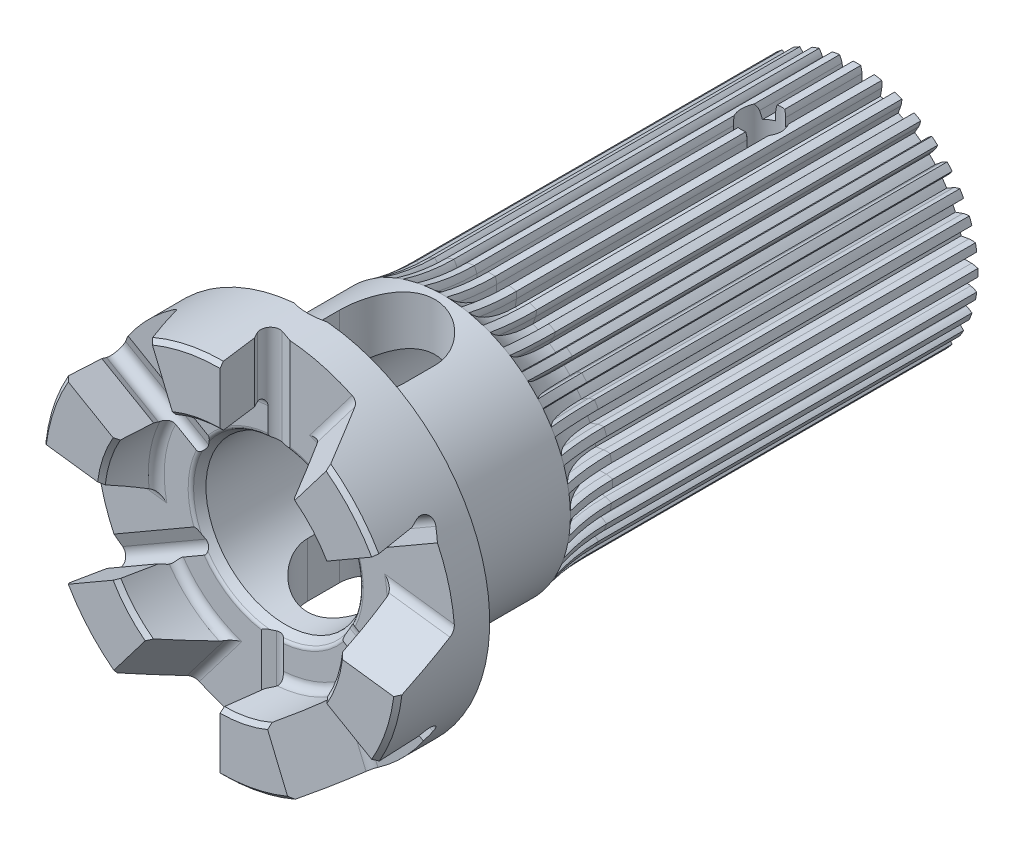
SolidWorks part; units mm, degrees
other "Исправление1"
sketch "Эскиз13" plane through (-22.5, 22.5, -80) normal (-0.4507, 0.8926, -0.0137) x (0.0569, 0.0134, -0.9983)
other "Исправление2"
sketch "Эскиз15" plane through (-22.5, -22.5, -80) normal (-0.1822, -0.9519, -0.2463) x (0.0762, -0.2634, 0.9617)
ref_plane "Спереди" through (0, 0, 0) normal (0, 0, 1) x (1, 0, 0)
ref_plane "Сверху" through (0, 0, 0) normal (0, 1, 0) x (1, 0, 0)
ref_plane "Справа" through (0, 0, 0) normal (1, 0, 0) x (0, 0, -1)
sketch "Эскиз1" plane through (0, 0, 0) normal (1, 0, 0) x (0, 0, -1)
  line L0 (0, 22.5) -> (0, 0) construction
  line L1 (0, 0) -> (80, 0) construction
  line L2 (0.5, 22.5) -> (11.3738, 22.5)
  line L6 (7, 15) -> (0.5, 15)
  line L7 (0, 15.5) -> (0, 22)
  line L8 (7, 15) -> (7, 11)
  line L9 (7.25, 10.567) -> (8.2321, 10)
  line L10 (8.2321, 10) -> (78.5, 10)
  line L13 (14, 16) -> (11.3738, 22.5)
  line L18 (0, 22) -> (0.5, 22.5)
  line L19 (0.5, 15) -> (0, 15.5)
  line L22 (14, 16) -> (28, 16)
  line L23 (34.1188, 13.4) -> (80, 13.4)
  line L24 (80, 13.4) -> (80, 10.866)
  line L25 (80, 10.866) -> (78.5, 10)
  arc A0 (7.25, 10.567) -> (7, 11) centre (7.5, 11) cw
  arc A3 (34.1188, 13.4) -> (28, 16) centre (34.1188, 21.9) cw
  point P3 (0, 22.5)
  point P10 (0, 15)
  dimension "D6" = 0.5
  dimension "D11" = 32
  dimension "D12" = 1.5
  dimension "D8" = 8.5
  dimension "D1" = 30
  dimension "D2" = 45
  dimension "D3" = 20
  dimension "D4" = 7
  dimension "D5" = 30
  dimension "D7" = 22
  dimension "D10" = 26.8
  dimension "D13" = 30
  dimension "D14" = 22
  dimension "D15" = 80
  dimension "D17" = 0.5
  dimension "D18" = 45
  dimension "D19" = 0.5
  dimension "D20" = 45
  dimension "D22" = 52
  dimension "D23" = 66
revolve "Повернуть1" add sketch "Эскиз1" angle 360 about L1
sketch "Эскиз2" plane through (0, 0, 0) normal (0, 0, 1) x (1, 0, 0)
  line L0 (0, 0) -> (0, 22.5) construction
  line L1 (-19.4856, -11.25) -> (0, 0) construction
  line L3 (0, 0) -> (0, -22.5) construction
  circle A0 centre (0, 0) radius 22.5 construction
  dimension "D1" = 60
ref_plane "Плоскость1" through (0, 0, 0) normal (0.5, -0.866, 0) x (0.866, 0.5, 0)
sketch "Эскиз4" plane through (0, 0, 0) normal (0, 0, 1) x (1, 0, 0)
  line L0 (0, -22.5) -> (0, 22.5) construction
  line L1 (0, 0) -> (-19.4856, 11.25) construction
  line L3 (0, 0) -> (-9.412, 22.5)
  circle A0 centre (0, 0) radius 22.5 construction
  point P4 (0, 0)
  dimension "D1" = 120
  dimension "D2" = 37.3
sketch "Эскиз3" plane through (0, 0, 0) normal (0.5, -0.866, 0) x (0.866, 0.5, 0)
  line L0 (0, 0) -> (-4.0415, -7)
  line L3 (-4.0415, -7) -> (-7, -7)
  line L5 (0, 0) -> (11.25, 0) construction
  line L7 (0, 0) -> (-11.25, 0) construction
  line L12 (-7, -7) -> (-7, 0)
  line L13 (-15, 0) -> (15, 0) construction
  line L14 (0, 0) -> (-7, 0)
  dimension "D1" = 60
  dimension "D2" = 7
  dimension "D3" = 7
sweep "Вырез-По траектории1" cut profiles "Эскиз3" path "Эскиз4"
sketch "Эскиз5" plane through (0, 0, 0) normal (0, 0, 1) x (1, 0, 0)
  line L0 (0, -18.5017) -> (0, 18.5017) construction
  line L1 (-12.9904, 7.5) -> (-19.4856, 11.25)
  line L2 (-5.9815, 14.2993) -> (-8.4899, 20.2958) construction
  line L5 (-12.9904, 7.5) -> (0, 0) construction
  line L6 (-11.5365, 9.5869) -> (-14.6645, 17.0646) construction
  line L7 (-11.5365, 9.5869) -> (-14.6645, 17.0646)
  circle A0 centre (0, 0) radius 15 construction
  arc A1 (-14.6645, 17.0646) -> (-19.4856, 11.25) centre (0, 0) ccw
  arc A3 (-11.5365, 9.5869) -> (-12.9904, 7.5) centre (0, 0) ccw
  circle A5 centre (0, 0) radius 22.5 construction
  point P4 (0, 0)
  dimension "D1" = 37.3
extrude "Вырез-Вытянуть1" cut sketch "Эскиз5" against normal up to surface (7 mm away)
pattern_circular "Круговой массив1" count 6 over 360 about axis through (0, 0, 0) along (0, 0, 1) of "Вырез-По траектории1", "Вырез-Вытянуть1"
fillet "Скругление1" radius 1.2 12 edges at (-7.8991, -16.9842, -7) (-7.2728, -13.1189, -3.7798) (10.7592, -15.3329, -7) (7.7249, -12.8579, -3.7798) (18.6583, 1.6513, -7) (14.9977, 0.261, -3.7798) (7.8991, 16.9842, -7) (7.2728, 13.1189, -3.7798) (-10.7592, 15.3329, -7) (-7.7249, 12.8579, -3.7798) (-18.6583, -1.6513, -7) (-14.9977, -0.261, -3.7798)
sketch "Эскиз6" plane through (0, 0, 0) normal (0, 1, 0) x (1, 0, 0)
  line L0 (0, 0) -> (0.654, 4.9679)
  line L2 (0.654, 4.9679) -> (1.0591, 5.7459)
  line L3 (-1.7759, 7) -> (-0.3662, 7.4445)
  line L4 (-11, 7) -> (11, 7) construction
  line L5 (0, 0) -> (0, 7)
  line L6 (-0.0054, 7.5) -> (-1.7759, 7.5) construction
  line L7 (0, 0) -> (5.9815, 0) construction
  line L8 (0, 7) -> (-1.7759, 7)
  arc A0 (-0.3662, 7.4445) -> (1.0591, 5.7459) centre (-0.0054, 6.3) cw
  dimension "D6" = 1.2
  dimension "D1" = 7.5
  dimension "D2" = 20
  dimension "D3" = 0.3
  dimension "D4" = 45
  dimension "D5" = 7.5
extrude "Вырез-Вытянуть2" cut sketch "Эскиз6" against normal up to surface (22.5 mm away)
pattern_circular "Круговой массив2" count 6 over 360 about axis through (0, 0, 0) along (0, 0, 1) of "Вырез-Вытянуть2"
sketch "Эскиз7" plane through (0, 0, -80) normal (0, 0, -1) x (-1, 0, 0)
  line L0 (0, 0) -> (0, 29.1802) construction
  line L1 (0, 0) -> (44.1055, 0) construction
  line L2 (0, 0) -> (14.3863, -0.6281) construction
  line L3 (14.3863, -0.6281) -> (13.3849, -0.6352)
  line L4 (14.3863, 0.6281) -> (13.3849, 0.6352)
  circle A0 centre (0, 0) radius 13.4 construction
  circle A1 centre (0, 0) radius 14.3994 construction
  circle A2 centre (0, 0) radius 14.4 construction
  circle A3 centre (0, 0) radius 15.2
  arc A4 (14.3863, -0.6281) -> (14.3863, 0.6281) centre (0, 0) ccw
  spline S0 degree 4 poles (14.3863, -0.6281) (14.4307, -0.6278) (14.555, -0.621) (14.7901, -0.5845) (15.1652, -0.4922) (15.6373, -0.3247) (16.2219, -0.0558) (16.8738, 0.3238) (17.5488, 0.8043) (18.3977, 1.5296) (19.1666, 2.3406) (19.8849, 3.2528) (20.6428, 4.4101) (21.304, 5.6262) (21.9374, 7.1043) (22.4757, 8.8083) (22.8554, 10.554) (23.0834, 12.3258) (23.1666, 14.1098) (23.1114, 15.8951) (22.9247, 17.6707) (22.6514, 19.2098) (22.3691, 20.4029) (22.1294, 21.2641) (21.9697, 21.7948) (21.831, 22.2268) (21.6942, 22.6355) (21.5346, 23.0807) (21.4087, 23.4223) (21.256, 23.8118) (21.0985, 24.2032) (20.9344, 24.5927) (20.6366, 25.2715) (20.3725, 25.816) (20.0957, 26.3802) (19.9495, 26.6487) (19.8555, 26.8296) knots 0 0 0 0 0 0.005604 0.015718 0.02996 0.048734 0.068727 0.096889 0.125051 0.153212 0.209535 0.237696 0.271429 0.327752 0.384075 0.440398 0.496721 0.553044 0.609367 0.66569 0.722013 0.778336 0.806497 0.820578 0.834659 0.84874 0.86282 0.876901 0.890982 0.900036 0.909091 0.931818 0.954545 0.977273 1 1 1 1 1 construction
  spline S1 degree 4 poles (14.3863, -0.6281) (14.4307, -0.6278) (14.555, -0.621) (14.7901, -0.5845) (15.1652, -0.4922) (15.6373, -0.3247) (16.2219, -0.0558) (16.8738, 0.3238) (17.5488, 0.8043) (18.3977, 1.5296) (19.1666, 2.3406) (19.8849, 3.2528) (20.6428, 4.4101) (21.304, 5.6262) (21.9374, 7.1043) (22.4757, 8.8083) (22.8554, 10.554) (23.0834, 12.3258) (23.1666, 14.1098) (23.1114, 15.8951) (22.9247, 17.6707) (22.6514, 19.2098) (22.3691, 20.4029) (22.1294, 21.2641) (21.9697, 21.7948) (21.831, 22.2268) (21.6942, 22.6355) (21.5346, 23.0807) (21.4087, 23.4223) (21.256, 23.8118) (21.1637, 24.0412) (21.1141, 24.1623) (21.0891, 24.2225) knots 0 0 0 0 0 0.005604 0.015718 0.02996 0.048734 0.068727 0.096889 0.125051 0.153212 0.209535 0.237696 0.271429 0.327752 0.384075 0.440398 0.496721 0.553044 0.609367 0.66569 0.722013 0.778336 0.806497 0.820578 0.834659 0.84874 0.86282 0.876901 0.890982 0.900036 0.909091 0.909091 0.909091 0.909091 0.909091
  spline S2 degree 4 poles (14.3863, 0.6281) (14.4307, 0.6278) (14.555, 0.621) (14.7901, 0.5845) (15.1652, 0.4922) (15.6373, 0.3247) (16.2219, 0.0558) (16.8738, -0.3238) (17.5488, -0.8043) (18.3977, -1.5296) (19.1666, -2.3406) (19.8849, -3.2528) (20.6428, -4.4101) (21.304, -5.6262) (21.9374, -7.1043) (22.4757, -8.8083) (22.8554, -10.554) (23.0834, -12.3258) (23.1666, -14.1098) (23.1114, -15.8951) (22.9247, -17.6707) (22.6514, -19.2098) (22.3691, -20.4029) (22.1294, -21.2641) (21.9697, -21.7948) (21.831, -22.2268) (21.6942, -22.6355) (21.5346, -23.0807) (21.4087, -23.4223) (21.256, -23.8118) (21.1637, -24.0412) (21.1141, -24.1623) (21.0891, -24.2225) knots 0 0 0 0 0 0.005604 0.015718 0.02996 0.048734 0.068727 0.096889 0.125051 0.153212 0.209535 0.237696 0.271429 0.327752 0.384075 0.440398 0.496721 0.553044 0.609367 0.66569 0.722013 0.778336 0.806497 0.820578 0.834659 0.84874 0.86282 0.876901 0.890982 0.900036 0.909091 0.909091 0.909091 0.909091 0.909091
  point P15 (14.4, 0)
sketch "Эскиз8" plane through (0, 0, 0) normal (0, 1, 0) x (1, 0, 0)
  line L0 (0, 0) -> (0, 90.3886) construction
  line L1 (-15.2, 34.1188) -> (-15.2, 80)
  line L2 (-14.3863, 80) -> (-23.1385, 80) construction
  line L3 (13.4, 34.1188) -> (-13.4, 34.1188) construction
  arc A0 (-15.2, 34.1188) -> (-16, 28) centre (-39, 34.1188) cw
  dimension "D1" = 30.4
sweep "По траектории1" add profiles "Эскиз7" path "Эскиз8"
sketch "Эскиз9" plane through (0, 0, -80) normal (0, 0, -1) x (-1, 0, 0)
  line L0 (14.3863, 0.6281) -> (13.3849, 0.6352) construction
  line L1 (14.3863, -0.6281) -> (13.3849, -0.6352) construction
  line L2 (14.3863, 0.6281) -> (13.3849, 0.6352)
  line L3 (14.3863, -0.6281) -> (13.3849, -0.6352)
  arc A0 (14.3863, -0.6281) -> (14.3863, 0.6281) centre (0, 0) ccw construction
  circle A1 centre (0, 0) radius 15.2
  circle A2 centre (0, 0) radius 15.2
  arc A3 (14.3863, -0.6281) -> (14.3863, 0.6281) centre (0, 0) ccw
  spline S0 degree 4 poles (77.2683, -1998.2735) (7.9931, -55.9237) (9.53, -0.6079) (12.5334, 1.1402) (15.1652, 0.4922) (15.6373, 0.3247) (16.2219, 0.0558) (16.8738, -0.3238) (17.5488, -0.8043) (18.3977, -1.5296) (19.1666, -2.3406) (19.8849, -3.2528) (20.6428, -4.4101) (21.304, -5.6262) (21.9374, -7.1043) (22.4757, -8.8083) (22.8554, -10.554) (23.0834, -12.3258) (23.1666, -14.1098) (23.1114, -15.8951) (22.9247, -17.6707) (22.6514, -19.2098) (22.3691, -20.4029) (22.1294, -21.2641) (21.9697, -21.7948) (21.831, -22.2268) (21.6942, -22.6355) (21.5346, -23.0807) (21.4087, -23.4223) (20.2195, -26.4552) (20.6877, -24.566) (9.5983, -49.8321) (-746.0058, -1871.168) knots -0.29317 -0.29317 -0.29317 -0.29317 -0.29317 0.005604 0.015718 0.02996 0.048734 0.068727 0.096889 0.125051 0.153212 0.209535 0.237696 0.271429 0.327752 0.384075 0.440398 0.496721 0.553044 0.609367 0.66569 0.722013 0.778336 0.806497 0.820578 0.834659 0.84874 0.86282 0.876901 0.890982 0.900036 1.223111 1.223111 1.223111 1.223111 1.223111 only from (14.3863, 0.6281) to (21.0891, -24.2225) construction
  spline S1 degree 4 poles (77.2683, 1998.2735) (7.9931, 55.9237) (9.53, 0.6079) (12.5334, -1.1402) (15.1652, -0.4922) (15.6373, -0.3247) (16.2219, -0.0558) (16.8738, 0.3238) (17.5488, 0.8043) (18.3977, 1.5296) (19.1666, 2.3406) (19.8849, 3.2528) (20.6428, 4.4101) (21.304, 5.6262) (21.9374, 7.1043) (22.4757, 8.8083) (22.8554, 10.554) (23.0834, 12.3258) (23.1666, 14.1098) (23.1114, 15.8951) (22.9247, 17.6707) (22.6514, 19.2098) (22.3691, 20.4029) (22.1294, 21.2641) (21.9697, 21.7948) (21.831, 22.2268) (21.6942, 22.6355) (21.5346, 23.0807) (21.4087, 23.4223) (20.2195, 26.4552) (20.6877, 24.566) (9.5983, 49.8321) (-746.0058, 1871.168) knots -0.29317 -0.29317 -0.29317 -0.29317 -0.29317 0.005604 0.015718 0.02996 0.048734 0.068727 0.096889 0.125051 0.153212 0.209535 0.237696 0.271429 0.327752 0.384075 0.440398 0.496721 0.553044 0.609367 0.66569 0.722013 0.778336 0.806497 0.820578 0.834659 0.84874 0.86282 0.876901 0.890982 0.900036 1.223111 1.223111 1.223111 1.223111 1.223111 only from (14.3863, -0.6281) to (21.0891, 24.2225) construction
  spline S2 degree 4 poles (14.3863, 0.6281) (14.4307, 0.6278) (14.555, 0.621) (14.7901, 0.5845) (15.1652, 0.4922) (15.6373, 0.3247) (16.2219, 0.0558) (16.8738, -0.3238) (17.5488, -0.8043) (18.3977, -1.5296) (19.1666, -2.3406) (19.8849, -3.2528) (20.6428, -4.4101) (21.304, -5.6262) (21.9374, -7.1043) (22.4757, -8.8083) (22.8554, -10.554) (23.0834, -12.3258) (23.1666, -14.1098) (23.1114, -15.8951) (22.9247, -17.6707) (22.6514, -19.2098) (22.3691, -20.4029) (22.1294, -21.2641) (21.9697, -21.7948) (21.831, -22.2268) (21.6942, -22.6355) (21.5346, -23.0807) (21.4087, -23.4223) (21.256, -23.8118) (21.1637, -24.0412) (21.1141, -24.1623) (21.0891, -24.2225) knots 0 0 0 0 0 0.005604 0.015718 0.02996 0.048734 0.068727 0.096889 0.125051 0.153212 0.209535 0.237696 0.271429 0.327752 0.384075 0.440398 0.496721 0.553044 0.609367 0.66569 0.722013 0.778336 0.806497 0.820578 0.834659 0.84874 0.86282 0.876901 0.890982 0.900036 0.909091 0.909091 0.909091 0.909091 0.909091
  spline S3 degree 4 poles (14.3863, -0.6281) (14.4307, -0.6278) (14.555, -0.621) (14.7901, -0.5845) (15.1652, -0.4922) (15.6373, -0.3247) (16.2219, -0.0558) (16.8738, 0.3238) (17.5488, 0.8043) (18.3977, 1.5296) (19.1666, 2.3406) (19.8849, 3.2528) (20.6428, 4.4101) (21.304, 5.6262) (21.9374, 7.1043) (22.4757, 8.8083) (22.8554, 10.554) (23.0834, 12.3258) (23.1666, 14.1098) (23.1114, 15.8951) (22.9247, 17.6707) (22.6514, 19.2098) (22.3691, 20.4029) (22.1294, 21.2641) (21.9697, 21.7948) (21.831, 22.2268) (21.6942, 22.6355) (21.5346, 23.0807) (21.4087, 23.4223) (21.256, 23.8118) (21.1637, 24.0412) (21.1141, 24.1623) (21.0891, 24.2225) knots 0 0 0 0 0 0.005604 0.015718 0.02996 0.048734 0.068727 0.096889 0.125051 0.153212 0.209535 0.237696 0.271429 0.327752 0.384075 0.440398 0.496721 0.553044 0.609367 0.66569 0.722013 0.778336 0.806497 0.820578 0.834659 0.84874 0.86282 0.876901 0.890982 0.900036 0.909091 0.909091 0.909091 0.909091 0.909091
  dimension "D1" = 0
sketch "Эскиз10" plane through (0, 0, 0) normal (0, 1, 0) x (1, 0, 0)
  line L0 (-15.2, 34.1188) -> (-15.2, 80) construction
  line L1 (-15.2, 34.1188) -> (-15.2, 80)
  arc A0 (-16, 28) -> (-15.2, 34.1188) centre (-39, 34.1188) ccw construction
  arc A1 (-16, 28) -> (-15.2, 34.1188) centre (-39, 34.1188) ccw
sweep "По траектории2" add profiles "Эскиз9" path "Эскиз10"
pattern_circular "Круговой массив3" count 36 over 360 of "По траектории1", "По траектории2"
sketch "Эскиз11" plane through (0, 0, 0) normal (0, 1, 0) x (1, 0, 0)
  line L0 (0, 0) -> (0, 80) construction
  line L1 (0.4738, 80) -> (-0.4738, 80) construction
  line L2 (0, 17) -> (0, 21) construction
  line L3 (-6, 17) -> (-6, 21)
  line L4 (6, 17) -> (6, 21)
  arc A0 (-6, 17) -> (6, 17) centre (0, 17) ccw
  arc A1 (6, 21) -> (-6, 21) centre (0, 21) ccw
  point P4 (0, 19)
  point P13 (0, 27)
  point P14 (0, 11)
  dimension "D3" = 6
  dimension "D1" = 27
  dimension "D2" = 16
extrude "Вырез-Вытянуть3" cut sketch "Эскиз11" against normal mid plane 55
sketch "Эскиз12" plane through (0, 0, 0) normal (0, 1, 0) x (1, 0, 0)
  line L0 (0, 0) -> (0, 80) construction
  line L1 (10.866, 80) -> (-10.866, 80) construction
  circle A0 centre (0, 68) radius 2.5
  dimension "D1" = 5
  dimension "D2" = 12
extrude "Вырез-Вытянуть4" cut sketch "Эскиз12" against normal mid plane 40
sketch "Эскиз" plane through (0, 0, -80) normal (0, 0, -1) x (-1, 0, 0)
  line L0 (0, 0) -> (0, 22.5) construction
  line L1 (0, 0) -> (-22.5, 0) construction
  line L2 (0, 0) -> (16, 0) construction
  line L4 (13.3074, -1.75) -> (16, -1.75)
  line L5 (13.3074, -1.75) -> (13.3074, 1.75)
  line L6 (13.3074, 1.75) -> (16, 1.75)
  line L7 (16, -1.75) -> (16, 1.75)
  arc A0 (2.0848, 22.4032) -> (-2.0848, 22.4032) centre (0, 0) ccw construction
  arc A1 (-2.0848, 22.4032) -> (-2.0848, -22.4032) centre (0, 0) ccw construction
  arc A2 (5.1962, -15.1327) -> (5.1962, 15.1327) centre (0, 0) ccw construction
  point P25 (13.3074, 0)
  dimension "D1" = 28.5
  dimension "D2" = 3.5
sketch "Эскиз14" plane through (0, 0, 0) normal (0, 1, 0) x (1, 0, 0)
  line L0 (0, 0) -> (0, 80) construction
  line L1 (0, 80) -> (-16, 80) construction
  line L2 (-13.4, 25) -> (-13.4, 80)
  line L4 (0, 80) -> (22.5, 80) construction
  arc A0 (-16.15, 18.1125) -> (-13.4, 25) centre (-23.4, 25) ccw
  dimension "D3" = 20
  dimension "D1" = 26.8
  dimension "D2" = 55
  dimension "D4" = 32.3
sweep "Вырез-По траектории2" cut profiles "Эскиз" path "Эскиз14"
fillet "Скругление2" radius 1 5 edges at (9.1643, 11.875, -7) (-5.7019, 13.874, -7) (-14.8662, 1.9991, -7) (14.8662, -1.9991, -7) (5.7019, -13.874, -7)
fillet "Скругление3" radius 1.5 6 edges at (-16, 0, -14) (16, 0, -14) (-5.8777, 14.8813, -15.7945) (3.7289, 19.862, -12.2995) (5.8777, -14.8813, -15.7945) (-3.7289, -19.862, -12.2995)
sketch "Параметры роликов " [suppressed] plane through (0, 0, -80) normal (0, 0, -1) x (-1, 0, 0)
  line L0 (4.3302, 13.7335) -> (3.981, 12.795) construction
  line L1 (0, 0) -> (4.0354, 15.0535) construction
  line L2 (0, 0) -> (12.943, -3.4696) construction
  line L3 (0, 0) -> (-4.0354, -15.0535) construction
  line L5 (0, 0) -> (-14.4052, 3.8616) construction
  circle A0 centre (3.8611, 14.4033) radius 0.6732
  circle A1 centre (-3.8611, -14.4033) radius 0.6732
  arc A3 (12.795, -3.981) -> (13.0713, -2.9498) centre (0, 0) ccw construction
  spline S0 degree 3 poles (3.1979, 14.5188) (3.1537, 14.2611) (3.1156, 14.0385) (3.0329, 13.556) (2.9909, 13.3112) (2.9498, 13.0713) knots 0 0 0 0 0.000734 0.000734 0.001469 0.001469 0.001469 0.001469 construction
  point P14 (0, 0)
  dimension "D1" = 4
  dimension "D3" = 1.3464
  dimension "D2" = 31.17
equation "\"m\"= 0.8'Модуль"
equation "\"z\"= 36'Количество зубьев"
equation "\"b\"= 31.4'Ширина "
equation "\"D\"= \"m\" * \"z\"'Диаметр делительной окружности"
equation "\"а\"= 30 * pi / 180'Угол профиля исходного контура"
equation "\"Db\"= \"D\" * cos ( \"а\" )'Диаметр начальной окружности "
equation "\"Da\"= \"D\" + \"m\" * 2'Диаметр вершин"
equation "\"Df\"= \"D\" - \"m\" * 2.5'Диаметр впадин"
equation "\"Sd\"= \"m\" * pi / 2'Толщина по хорде делительной окружности"
equation "\"D1@Эскиз7\" = \"Df\""
equation "\"D3@Эскиз7\" = \"D\""
equation "\"D4@Эскиз7\" = \"Da\""
equation "\"D1@Круговой массив11\"=\"z\""
equation "\"D1@Круговой массив3\"=\"z\""
